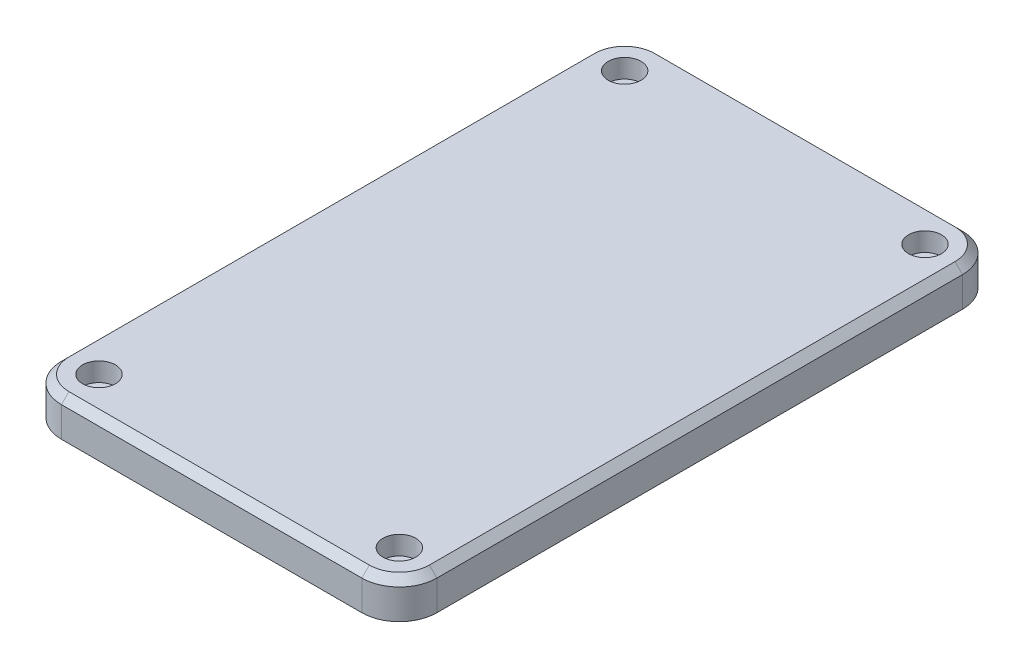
SolidWorks part; units mm, degrees
ref_plane "Front Plane" through (0, 0, 0) normal (0, 0, 1) x (1, 0, 0)
ref_plane "Top Plane" through (0, 0, 0) normal (0, 1, 0) x (1, 0, 0)
ref_plane "Right Plane" through (0, 0, 0) normal (1, 0, 0) x (0, 0, -1)
sketch "Sketch2" plane through (0, 0, 0) normal (0, 0, 1) x (1, 0, 0)
  line L1 (0, 0) -> (127, 0)
  line L2 (0, 0) -> (0, 12.7)
  line L3 (0, 12.7) -> (127, 12.7)
  line L4 (127, 0) -> (127, 12.7)
  dimension "D1" = 12.7
  dimension "D2" = 127
extrude "Extrude1" add sketch "Sketch2" along normal blind 203.2
fillet "Fillet1" radius 12.7 4 edges at (127, 6.35, 203.2) (0, 6.35, 203.2) (127, 6.35, 0) (0, 6.35, 0)
chamfer "Chamfer1" distance 2.54 angle 45 8 edges at (0, 12.7, 101.6) (63.5, 12.7, 0) (63.5, 12.7, 203.2) (127, 12.7, 101.6) (3.7197, 12.7, 199.4803) (123.2803, 12.7, 199.4803) (123.2803, 12.7, 3.7197) (3.7197, 12.7, 3.7197)
hole_wizard "CBORE for 1/4 Socket Head Cap Screw1" positions "Sketch4" profile "Sketch3" counterbore size "1/4" standard "Ansi Inch"
sketch "Sketch4" plane through (0, 12.7, 0) normal (0, 1, 0) x (-1, 0, 0)
  point P1 (-12.7, 12.7)
  point P4 (-114.3, 12.7)
  point P7 (-114.3, 190.5)
  point P10 (-12.7, 190.5)
sketch "Sketch3" plane through (12.7, 12.7, 12.7) normal (1, 0, 0) x (0, 0, 1)
  line L0 (0, 0) -> (0, 12.7)
  line L1 (0, 12.7) -> (3.3782, 12.7)
  line L3 (3.3782, 12.7) -> (3.3782, 6.35)
  line L4 (3.3782, 6.35) -> (5.5562, 6.35)
  line L5 (5.5562, 6.35) -> (5.5563, 0)
  line L7 (5.5563, 0) -> (0, 0)
  line L11 (0, -6.35) -> (0, 107.95) construction
  dimension "Thru Hole Dia." = 6.7564
  dimension "Thru Hole Depth" = 12.7
  dimension "C'Bore Dia." = 11.1125
  dimension "C'Bore Depth" = 6.35
